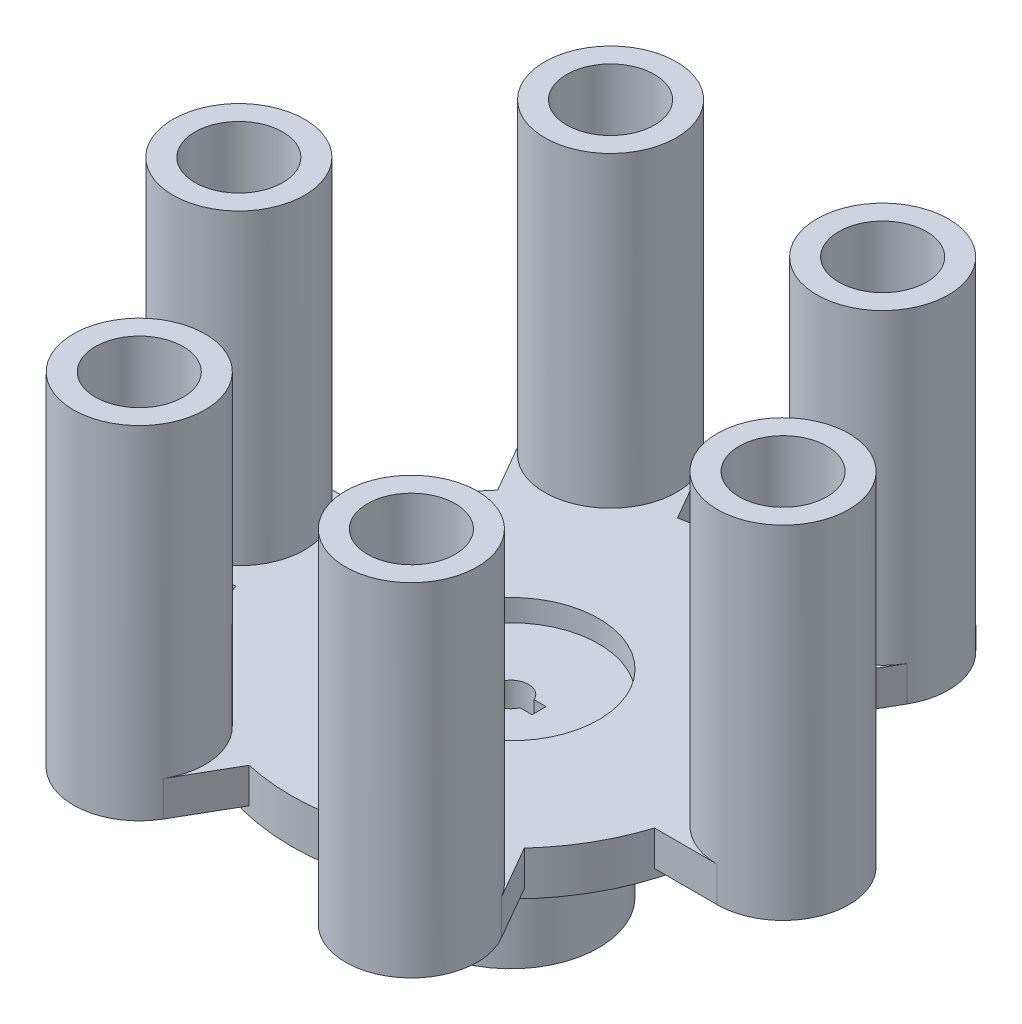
SolidWorks part; units mm, degrees
ref_plane "前视基准面" through (0, 0, 0) normal (0, 0, 1) x (1, 0, 0)
ref_plane "上视基准面" through (0, 0, 0) normal (0, 1, 0) x (1, 0, 0)
ref_plane "右视基准面" through (0, 0, 0) normal (1, 0, 0) x (0, 0, -1)
other "Configuration Table"
sketch "草图1" plane through (0, 0, 0) normal (0, 1, 0) x (1, 0, 0)
  circle A0 centre (0, 0) radius 10
  circle A1 centre (0, 0) radius 2
  dimension "D1" = 20
  dimension "D2" = 4
extrude "凸台-拉伸1" add sketch "草图1" along normal mid plane 20
sketch "草图2" plane through (0, 10, 0) normal (0, 1, 0) x (1, 0, 0)
  line L0 (0, 0) -> (4.544, 0) construction
  line L2 (1.5979, 0.8) -> (3.2, 0.8)
  line L3 (1.5979, 0.8) -> (1.5979, -0.8)
  line L4 (1.5979, -0.8) -> (3.2, -0.8)
  line L5 (3.2, 0.8) -> (3.2, -0.8)
  line L6 (1.5979, 0.8) -> (3.2, -0.8) construction
  line L7 (1.5979, -0.8) -> (3.2, 0.8) construction
  point P3 (2.3989, 0)
  dimension "D1" = 3.2
  dimension "D2" = 1.6
extrude "切除-拉伸1" cut sketch "草图2" against normal blind 30
sketch "草图3" plane through (0, 10, 0) normal (0, 1, 0) x (1, 0, 0)
  circle A0 centre (0, 0) radius 25
  circle A1 centre (0, 0) radius 10
extrude "凸台-拉伸2" add sketch "草图3" along normal mid plane 5
sketch "草图4" plane through (0, 12.5, 0) normal (0, 1, 0) x (1, 0, 0)
  line L0 (0, 0) -> (31, 0) construction
  line L1 (0, 0) -> (0, 27.3949) construction
  line L2 (31, 7.5) -> (19.3699, 7.5)
  line L3 (31, -7.5) -> (19.3699, -7.5)
  line L4 (19.3699, -7.5) -> (19.3699, 7.5)
  line L5 (9.0048, -30.5968) -> (3.1898, -20.5248)
  line L6 (3.1898, -20.5248) -> (16.1801, -13.0248)
  line L7 (21.9952, -23.0968) -> (16.1801, -13.0248)
  line L8 (-21.9952, -23.0968) -> (-16.1801, -13.0248)
  line L9 (-16.1801, -13.0248) -> (-3.1898, -20.5248)
  line L10 (-9.0048, -30.5968) -> (-3.1898, -20.5248)
  line L11 (-31, 7.5) -> (-19.3699, 7.5)
  line L12 (-19.3699, 7.5) -> (-19.3699, -7.5)
  line L13 (-31, -7.5) -> (-19.3699, -7.5)
  line L14 (-9.0048, 30.5968) -> (-3.1898, 20.5248)
  line L15 (-3.1898, 20.5248) -> (-16.1801, 13.0248)
  line L16 (-21.9952, 23.0968) -> (-16.1801, 13.0248)
  line L17 (21.9952, 23.0968) -> (16.1801, 13.0248)
  line L18 (16.1801, 13.0248) -> (3.1898, 20.5248)
  line L19 (9.0048, 30.5968) -> (3.1898, 20.5248)
  arc A0 (31, -7.5) -> (31, 7.5) centre (31, 0) ccw
  arc A1 (9.0048, -30.5968) -> (21.9952, -23.0968) centre (15.5, -26.8468) ccw
  circle A2 centre (0, 0) radius 31 construction
  arc A3 (-21.9952, -23.0968) -> (-9.0048, -30.5968) centre (-15.5, -26.8468) ccw
  arc A4 (-31, 7.5) -> (-31, -7.5) centre (-31, 0) ccw
  arc A5 (-9.0048, 30.5968) -> (-21.9952, 23.0968) centre (-15.5, 26.8468) ccw
  arc A6 (21.9952, 23.0968) -> (9.0048, 30.5968) centre (15.5, 26.8468) ccw
  point P51 (0, 0)
  dimension "D3" = 6
extrude "凸台-拉伸3" add sketch "草图4" against normal blind 4
sketch "草图5" plane through (0, 12.5, 0) normal (0, 1, 0) x (1, 0, 0)
  line L0 (0, 0) -> (19.25, -33.342) construction
  circle A0 centre (15.5, -26.8468) radius 5
  circle A1 centre (0, 0) radius 31 construction
  arc A3 (9.0048, -30.5968) -> (21.9952, -23.0968) centre (15.5, -26.8468) ccw construction
  circle A4 centre (-15.5, -26.8468) radius 5
  circle A5 centre (-31, 0) radius 5
  circle A6 centre (-15.5, 26.8468) radius 5
  circle A7 centre (15.5, 26.8468) radius 5
  circle A8 centre (31, 0) radius 5
  point P21 (0, 0)
  dimension "D1" = 10
  dimension "D2" = 62
  dimension "D3" = 6
extrude "切除-拉伸2" cut sketch "草图5" against normal blind 8
sketch "草图6" plane through (0, 12.5, 0) normal (0, 1, 0) x (1, 0, 0)
  line L12 (18.4194, 16.9034) -> (21.9952, 23.0968)
  line L13 (9.0048, 30.5968) -> (5.429, 24.4034)
  line L14 (-5.429, 24.4034) -> (-9.0048, 30.5968)
  line L15 (-21.9952, 23.0968) -> (-18.4194, 16.9034)
  line L16 (-23.8485, 7.5) -> (-31, 7.5)
  line L17 (-31, -7.5) -> (-23.8485, -7.5)
  line L18 (-18.4194, -16.9034) -> (-21.9952, -23.0968)
  line L19 (-9.0048, -30.5968) -> (-5.429, -24.4034)
  line L20 (5.429, -24.4034) -> (9.0048, -30.5968)
  line L21 (21.9952, -23.0968) -> (18.4194, -16.9034)
  line L22 (23.8485, -7.5) -> (31, -7.5)
  line L23 (31, 7.5) -> (23.8485, 7.5)
  circle A0 centre (-15.5, -26.8468) radius 7.5
  circle A1 centre (-15.5, -26.8468) radius 5 construction
  circle A2 centre (-15.5, -26.8468) radius 5
  arc A12 (23.8485, 7.5) -> (18.4194, 16.9034) centre (0, 0) ccw
  arc A13 (21.9952, 23.0968) -> (9.0048, 30.5968) centre (15.5, 26.8468) ccw
  arc A14 (5.429, 24.4034) -> (-5.429, 24.4034) centre (0, 0) ccw
  arc A15 (-9.0048, 30.5968) -> (-21.9952, 23.0968) centre (-15.5, 26.8468) ccw
  arc A16 (-18.4194, 16.9034) -> (-23.8485, 7.5) centre (0, 0) ccw
  arc A17 (-31, 7.5) -> (-31, -7.5) centre (-31, 0) ccw
  arc A18 (-23.8485, -7.5) -> (-18.4194, -16.9034) centre (0, 0) ccw
  arc A19 (-21.9952, -23.0968) -> (-9.0048, -30.5968) centre (-15.5, -26.8468) ccw
  arc A20 (-5.429, -24.4034) -> (5.429, -24.4034) centre (0, 0) ccw
  arc A21 (9.0048, -30.5968) -> (21.9952, -23.0968) centre (15.5, -26.8468) ccw
  arc A22 (18.4194, -16.9034) -> (23.8485, -7.5) centre (0, 0) ccw
  arc A23 (31, -7.5) -> (31, 7.5) centre (31, 0) ccw
  arc A31 (-21.9952, -23.0968) -> (-9.0048, -30.5968) centre (-15.5, -26.8468) ccw
  dimension "D1" = 0
extrude "凸台-拉伸4" add sketch "草图6" along normal blind 35 contours A0 M45 M29
pattern_circular "阵列(圆周)1" count 6 over 360 of "凸台-拉伸4"
